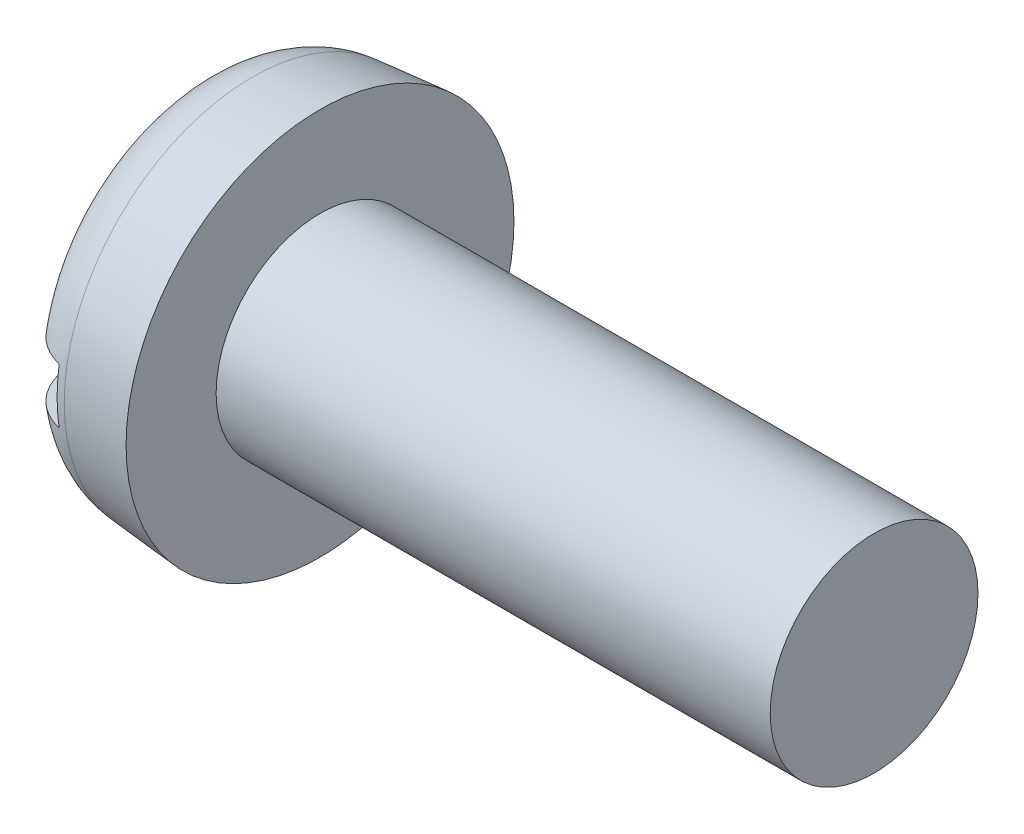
SolidWorks part; units mm, degrees
ref_plane "Plane1" through (0, 0, 0) normal (0, 0, 1) x (1, 0, 0)
ref_plane "Plane2" through (0, 0, 0) normal (0, 1, 0) x (1, 0, 0)
ref_plane "Plane3" through (0, 0, 0) normal (1, 0, 0) x (0, 0, -1)
sketch "BodySke" plane through (0, 0, 0) normal (0, 0, 1) x (1, 0, 0)
  line L0 (1.8, 1.5) -> (1.8, 2.8)
  line L1 (0, 0) -> (0, 2.6425)
  line L2 (-25.4, 0) -> (127, 0) construction
  line L3 (9.8, 0) -> (0, 0)
  line L4 (1.8, 1.5) -> (9.8, 1.5)
  line L5 (9.8, 1.5) -> (9.8, 0)
  line L6 (0, 2.6425) -> (1.8, 2.8)
  line L9 (2.3, 3.0875) -> (2.3, -6.4375) construction
  line L10 (1.8, 6.35) -> (1.8, -3.175) construction
  dimension "Head_ht" = 1.8
  dimension "Diameter" = 3
  dimension "Length" = 8
  dimension "Head_dia" = 5.6
  dimension "Advance" = 0.5
  dimension "Thread_nom" = 8
  dimension "Head_side_angle" = 5
revolve "Base-Revolve" add sketch "BodySke"
fillet "Fillet1" [suppressed] radius 0.1
fillet "Fillet2" radius 0.9 1 edges at (0, 0, 2.6425)
sketch "Sketch2" plane through (0, 0, 0) normal (1, 0, 0) x (0, 0, -1)
  line L0 (2.8, -0.4) -> (-2.8, -0.4)
  line L1 (2.8, -0.4) -> (2.8, 0.4)
  line L2 (-2.8, 0.4) -> (2.8, 0.4)
  line L3 (-2.8, 0.4) -> (-2.8, -0.4)
  dimension "D1" = 5.6
  dimension "D2" = 2.8
  dimension "Slot_width" = 0.8
  dimension "D3" = 0.4
extrude "Slot" cut sketch "Sketch2" along normal blind 0.7
sketch "ThdSchSke" plane through (0, 0, 0) normal (0, 0, 1) x (1, 0, 0)
  line L0 (2.8, -1.2195) -> (2.6036, -1.5)
  line L1 (2.8, -1.2195) -> (2.9964, -1.5)
  line L2 (2.9964, -1.5) -> (2.9964, -1.875)
  line L3 (-3.175, 0) -> (5.1513, 0) construction
  line L5 (2.9964, -1.875) -> (2.6036, -1.875)
  line L6 (2.6036, -1.875) -> (2.6036, -1.5)
  dimension "Thread_minor" = 2.439
  dimension "Diameter" = 3
  dimension "Start" = 2.8
  dimension "SideAngle" = 55
  dimension "VeeAngle" = 70
  dimension "Overcut" = 3.75
revolve "ThreadSchematic" [suppressed] cut sketch "ThdSchSke" angle 360 about L3
pattern_linear "ThdSchPat" [suppressed]
equation "\"D1@Sketch2\" = \"Head_dia@BodySke\""
equation "\"D2@Sketch2\" = \"D1@Sketch2\" / 2"
equation "\"D3@Sketch2\" = \"Slot_width@Sketch2\" / 2"
equation "\"Thread_length@ThreadCosmetic\" = ((sgn( (\"Length@BodySke\" - \"Advance@BodySke\" * 2.0 ) - \"Thread_nom@BodySke\" )-1)*( (\"Length@BodySke\" - \"Advance@BodySke\"  * 2.0) - \"Thread_nom@BodySke\" ))/-2+ \"Thread_"
equation "\"Thread_minor@ThdSchSke\" = \"Thread_minor@ThreadCosmetic\""
equation "\"Diameter@ThdSchSke\" = \"Diameter@BodySke\""
equation "\"Overcut@ThdSchSke\" = \"Diameter@BodySke\" * 1.25"
equation "\"Start@ThdSchSke\" = \"Head_ht@BodySke\" + \"Length@BodySke\" - \"Thread_length@ThreadCosmetic\"  '---Non-countersunk---"
equation "\"Num_threads@ThdSchPat\" = int( \"Thread_length@ThreadCosmetic\" / \"Advance@BodySke\" + 0.999 )  + 1"
equation "\"Advance@ThdSchPat\" = \"Thread_length@ThreadCosmetic\" /  (\"Num_threads@ThdSchPat\" - 1) 'relax it"
